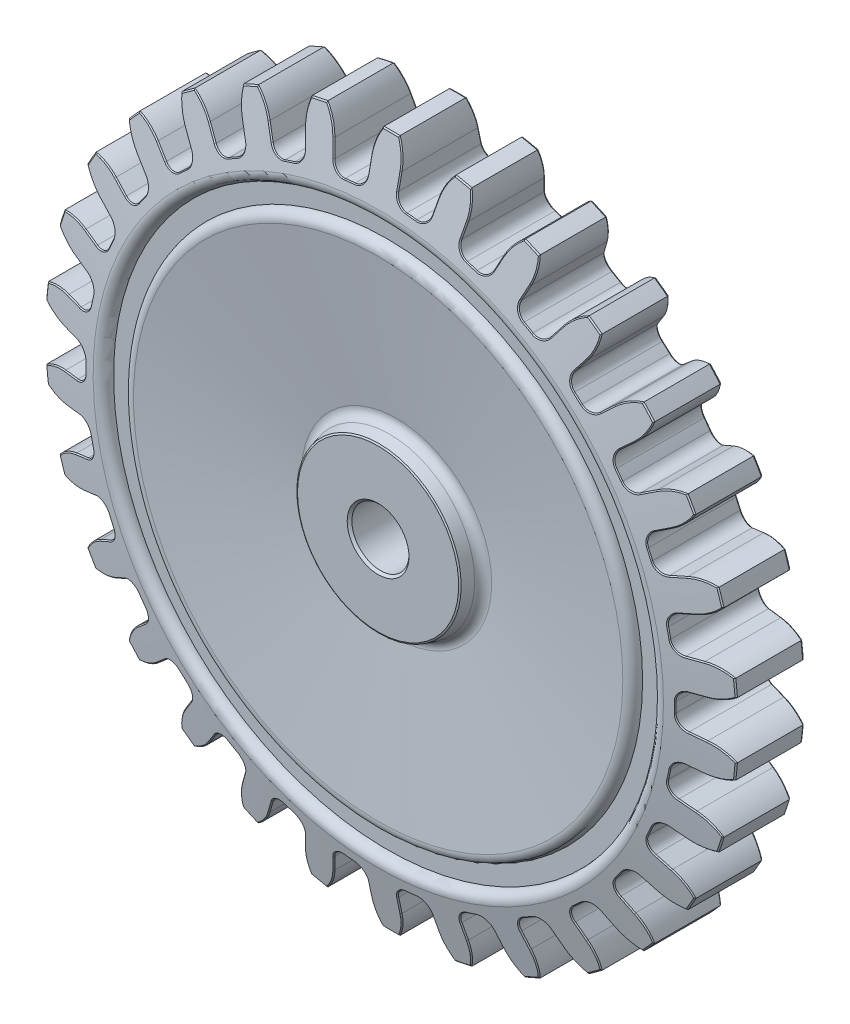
SolidWorks part; units mm, degrees
ref_plane "Спереди" through (0, 0, 0) normal (0, 0, 1) x (1, 0, 0)
ref_plane "Сверху" through (0, 0, 0) normal (0, 1, 0) x (1, 0, 0)
ref_plane "Справа" through (0, 0, 0) normal (1, 0, 0) x (0, 0, -1)
sketch "Эскиз2" plane through (0, 0, 0) normal (1, 0, 0) x (0, 0, -1)
  line L0 (-9.4803, 0) -> (8.8412, 0) construction
  line L1 (-5, 3.05) -> (5, 3.05)
  line L2 (5, 3.05) -> (5, 8.75)
  line L3 (-3.6, 37) -> (3.6, 37)
  line L4 (0, 0) -> (0, 37) construction
  line L5 (4, 29.25) -> (4, 27.25)
  line L6 (5, 8.75) -> (5, 36.8) construction
  line L7 (3.6, 37) -> (4.9785, 30.4561)
  line L8 (5, 8.75) -> (3.7666, 9.0805)
  line L9 (4.9925, 26.1281) -> (3.0329, 10.1683)
  line L10 (-5, 3.05) -> (-5, 8.75)
  line L11 (-5, 8.75) -> (-3.7666, 9.0805)
  line L12 (-4.9925, 26.1281) -> (-3.0329, 10.1683)
  line L13 (-4, 29.25) -> (-4, 27.25)
  line L14 (-3.6, 37) -> (-4.9785, 30.4561)
  arc A0 (4, 29.25) -> (4.9785, 30.4561) centre (4, 30.25) ccw
  arc A1 (4.9925, 26.1281) -> (4, 27.25) centre (4, 26.25) ccw
  arc A2 (3.0329, 10.1683) -> (3.7666, 9.0805) centre (4.0255, 10.0464) ccw
  arc A3 (-3.0329, 10.1683) -> (-3.7666, 9.0805) centre (-4.0255, 10.0464) cw
  arc A4 (-4.9925, 26.1281) -> (-4, 27.25) centre (-4, 26.25) cw
  arc A5 (-4, 29.25) -> (-4.9785, 30.4561) centre (-4, 30.25) cw
  point P19 (0, 3.05)
  dimension "D8" = 2
  dimension "D1" = 3.05
  dimension "D2" = 8.75
  dimension "D3" = 5
  dimension "D4" = 37
  dimension "D5" = 3.6
  dimension "D6" = 2
  dimension "D7" = 20.5
  dimension "D9" = 4
  dimension "D10" = 15
  dimension "D11" = 7
  dimension "D12" = 10.0464
revolve "Повернуть1" add sketch "Эскиз2" angle 360 about L0
sketch "Эскиз3" plane through (0, 0, 0) normal (0, 0, 1) x (1, 0, 0)
  line L0 (0, 42.1478) -> (0, 0) construction
  line L1 (0, 0) -> (3.6062, 34.311) construction
  line L2 (-1.6, 34.311) -> (-1.6, 32.6441)
  line L3 (1.6, 34.311) -> (1.6, 32.6441)
  line L4 (5.5686, 33.8939) -> (5.222, 32.2634)
  line L5 (8.6987, 33.2286) -> (8.3521, 31.5981)
  line L6 (12.4939, 31.9954) -> (11.8159, 30.4726)
  line L7 (15.4172, 30.6939) -> (14.7392, 29.1711)
  line L8 (18.8731, 28.6986) -> (17.8933, 27.3501)
  line L9 (21.4619, 26.8177) -> (20.4821, 25.4692)
  line L10 (24.4274, 24.1476) -> (23.1887, 23.0322)
  line L11 (26.5687, 21.7695) -> (25.3299, 20.6541)
  line L12 (28.9142, 18.5411) -> (27.4706, 17.7077)
  line L13 (30.5142, 15.7699) -> (29.0706, 14.9364)
  line L14 (32.1373, 12.1244) -> (30.5519, 11.6093)
  line L15 (33.1261, 9.081) -> (31.5408, 8.5659)
  line L16 (33.9558, 5.1777) -> (32.298, 5.0035)
  line L17 (34.2903, 1.9952) -> (32.6325, 1.821)
  line L18 (34.2903, -1.9952) -> (32.6325, -1.821)
  line L19 (33.9558, -5.1777) -> (32.298, -5.0035)
  line L20 (33.1261, -9.081) -> (31.5408, -8.5659)
  line L21 (32.1373, -12.1244) -> (30.5519, -11.6093)
  line L22 (30.5142, -15.7699) -> (29.0706, -14.9364)
  line L23 (28.9142, -18.5411) -> (27.4706, -17.7077)
  line L24 (26.5687, -21.7695) -> (25.3299, -20.6541)
  line L25 (24.4274, -24.1476) -> (23.1887, -23.0322)
  line L26 (21.4619, -26.8177) -> (20.4821, -25.4692)
  line L27 (18.8731, -28.6986) -> (17.8933, -27.3501)
  line L28 (15.4172, -30.6939) -> (14.7392, -29.1711)
  line L29 (12.4939, -31.9954) -> (11.8159, -30.4726)
  line L30 (8.6987, -33.2286) -> (8.3521, -31.5981)
  line L31 (5.5686, -33.8939) -> (5.222, -32.2634)
  line L32 (1.6, -34.311) -> (1.6, -32.6441)
  line L33 (-1.6, -34.311) -> (-1.6, -32.6441)
  line L34 (-5.5686, -33.8939) -> (-5.222, -32.2634)
  line L35 (-8.6987, -33.2286) -> (-8.3521, -31.5981)
  line L36 (-12.4939, -31.9954) -> (-11.8159, -30.4726)
  line L37 (-15.4172, -30.6939) -> (-14.7392, -29.1711)
  line L38 (-18.8731, -28.6986) -> (-17.8933, -27.3501)
  line L39 (-21.4619, -26.8177) -> (-20.4821, -25.4692)
  line L40 (-24.4274, -24.1476) -> (-23.1887, -23.0322)
  line L41 (-26.5687, -21.7695) -> (-25.3299, -20.6541)
  line L42 (-28.9142, -18.5411) -> (-27.4706, -17.7077)
  line L43 (-30.5142, -15.7699) -> (-29.0706, -14.9364)
  line L44 (-32.1373, -12.1244) -> (-30.5519, -11.6093)
  line L45 (-33.1261, -9.081) -> (-31.5408, -8.5659)
  line L46 (-33.9558, -5.1777) -> (-32.298, -5.0035)
  line L47 (-34.2903, -1.9952) -> (-32.6325, -1.821)
  line L48 (-34.2903, 1.9952) -> (-32.6325, 1.821)
  line L49 (-33.9558, 5.1777) -> (-32.298, 5.0035)
  line L50 (-33.1261, 9.081) -> (-31.5408, 8.5659)
  line L51 (-32.1373, 12.1244) -> (-30.5519, 11.6093)
  line L52 (-30.5142, 15.7699) -> (-29.0706, 14.9364)
  line L53 (-28.9142, 18.5411) -> (-27.4706, 17.7077)
  line L54 (-26.5687, 21.7695) -> (-25.3299, 20.6541)
  line L55 (-24.4274, 24.1476) -> (-23.1887, 23.0322)
  line L56 (-21.4619, 26.8177) -> (-20.4821, 25.4692)
  line L57 (-18.8731, 28.6986) -> (-17.8933, 27.3501)
  line L58 (-15.4172, 30.6939) -> (-14.7392, 29.1711)
  line L59 (-12.4939, 31.9954) -> (-11.8159, 30.4726)
  line L60 (-8.6987, 33.2286) -> (-8.3521, 31.5981)
  line L61 (-5.5686, 33.8939) -> (-5.222, 32.2634)
  circle A0 centre (0, 0) radius 34.5 construction
  arc A1 (-0.8578, 36.9901) -> (-1.6, 34.311) centre (3.6062, 34.311) ccw
  arc A2 (-9.2225, 30.1197) -> (-10.2427, 29.7882) centre (0, 0) ccw
  circle A3 centre (0, 0) radius 37 construction
  arc A4 (0.8578, 36.9901) -> (-0.8578, 36.9901) centre (0, 0) ccw
  arc A5 (0.8578, 36.9901) -> (1.6, 34.311) centre (-3.6062, 34.311) cw
  arc A6 (6.8516, 36.3601) -> (5.5686, 33.8939) centre (10.6611, 32.8114) ccw
  arc A7 (8.5297, 36.0034) -> (6.8516, 36.3601) centre (0, 0) ccw
  arc A8 (8.5297, 36.0034) -> (8.6987, 33.2286) centre (3.6062, 34.311) cw
  arc A9 (14.2616, 34.141) -> (12.4939, 31.9954) centre (17.25, 29.8779) ccw
  arc A10 (15.8288, 33.4432) -> (14.2616, 34.141) centre (0, 0) ccw
  arc A11 (15.8288, 33.4432) -> (15.4172, 30.6939) centre (10.6611, 32.8114) cw
  arc A12 (21.0482, 30.4298) -> (18.8731, 28.6986) centre (23.085, 25.6385) ccw
  arc A13 (22.4362, 29.4214) -> (21.0482, 30.4298) centre (0, 0) ccw
  arc A14 (22.4362, 29.4214) -> (21.4619, 26.8177) centre (17.25, 29.8779) cw
  arc A15 (26.915, 25.3886) -> (24.4274, 24.1476) centre (27.9111, 20.2786) ccw
  arc A16 (28.0629, 24.1137) -> (26.915, 25.3886) centre (0, 0) ccw
  arc A17 (28.0629, 24.1137) -> (26.5687, 21.7695) centre (23.085, 25.6385) cw
  arc A18 (31.6054, 19.2379) -> (28.9142, 18.5411) centre (31.5173, 14.0324) ccw
  arc A19 (32.4632, 17.7522) -> (31.6054, 19.2379) centre (0, 0) ccw
  arc A20 (32.4632, 17.7522) -> (30.5142, 15.7699) centre (27.9111, 20.2786) cw
  arc A21 (34.9146, 12.2464) -> (32.1373, 12.1244) centre (33.7461, 7.173) ccw
  arc A22 (35.4447, 10.6147) -> (34.9146, 12.2464) centre (0, 0) ccw
  arc A23 (35.4447, 10.6147) -> (33.1261, 9.081) centre (31.5173, 14.0324) cw
  arc A24 (36.6978, 4.7196) -> (33.9558, 5.1777) centre (34.5, 0) ccw
  arc A25 (36.8771, 3.0134) -> (36.6978, 4.7196) centre (0, 0) ccw
  arc A26 (36.8771, 3.0134) -> (34.2903, 1.9952) centre (33.7461, 7.173) cw
  arc A27 (36.8771, -3.0134) -> (34.2903, -1.9952) centre (33.7461, -7.173) ccw
  arc A28 (36.6978, -4.7196) -> (36.8771, -3.0134) centre (0, 0) ccw
  arc A29 (36.6978, -4.7196) -> (33.9558, -5.1777) centre (34.5, 0) cw
  arc A30 (35.4447, -10.6147) -> (33.1261, -9.081) centre (31.5173, -14.0324) ccw
  arc A31 (34.9146, -12.2464) -> (35.4447, -10.6147) centre (0, 0) ccw
  arc A32 (34.9146, -12.2464) -> (32.1373, -12.1244) centre (33.7461, -7.173) cw
  arc A33 (32.4632, -17.7522) -> (30.5142, -15.7699) centre (27.9111, -20.2786) ccw
  arc A34 (31.6054, -19.2379) -> (32.4632, -17.7522) centre (0, 0) ccw
  arc A35 (31.6054, -19.2379) -> (28.9142, -18.5411) centre (31.5173, -14.0324) cw
  arc A36 (28.0629, -24.1137) -> (26.5687, -21.7695) centre (23.085, -25.6385) ccw
  arc A37 (26.915, -25.3886) -> (28.0629, -24.1137) centre (0, 0) ccw
  arc A38 (26.915, -25.3886) -> (24.4274, -24.1476) centre (27.9111, -20.2786) cw
  arc A39 (22.4362, -29.4214) -> (21.4619, -26.8177) centre (17.25, -29.8779) ccw
  arc A40 (21.0482, -30.4298) -> (22.4362, -29.4214) centre (0, 0) ccw
  arc A41 (21.0482, -30.4298) -> (18.8731, -28.6986) centre (23.085, -25.6385) cw
  arc A42 (15.8288, -33.4432) -> (15.4172, -30.6939) centre (10.6611, -32.8114) ccw
  arc A43 (14.2616, -34.141) -> (15.8288, -33.4432) centre (0, 0) ccw
  arc A44 (14.2616, -34.141) -> (12.4939, -31.9954) centre (17.25, -29.8779) cw
  arc A45 (8.5297, -36.0034) -> (8.6987, -33.2286) centre (3.6062, -34.311) ccw
  arc A46 (6.8516, -36.3601) -> (8.5297, -36.0034) centre (0, 0) ccw
  arc A47 (6.8516, -36.3601) -> (5.5686, -33.8939) centre (10.6611, -32.8114) cw
  arc A48 (0.8578, -36.9901) -> (1.6, -34.311) centre (-3.6062, -34.311) ccw
  arc A49 (-0.8578, -36.9901) -> (0.8578, -36.9901) centre (0, 0) ccw
  arc A50 (-0.8578, -36.9901) -> (-1.6, -34.311) centre (3.6062, -34.311) cw
  arc A51 (-6.8516, -36.3601) -> (-5.5686, -33.8939) centre (-10.6611, -32.8114) ccw
  arc A52 (-8.5297, -36.0034) -> (-6.8516, -36.3601) centre (0, 0) ccw
  arc A53 (-8.5297, -36.0034) -> (-8.6987, -33.2286) centre (-3.6062, -34.311) cw
  arc A54 (-14.2616, -34.141) -> (-12.4939, -31.9954) centre (-17.25, -29.8779) ccw
  arc A55 (-15.8288, -33.4432) -> (-14.2616, -34.141) centre (0, 0) ccw
  arc A56 (-15.8288, -33.4432) -> (-15.4172, -30.6939) centre (-10.6611, -32.8114) cw
  arc A57 (-21.0482, -30.4298) -> (-18.8731, -28.6986) centre (-23.085, -25.6385) ccw
  arc A58 (-22.4362, -29.4214) -> (-21.0482, -30.4298) centre (0, 0) ccw
  arc A59 (-22.4362, -29.4214) -> (-21.4619, -26.8177) centre (-17.25, -29.8779) cw
  arc A60 (-26.915, -25.3886) -> (-24.4274, -24.1476) centre (-27.9111, -20.2786) ccw
  arc A61 (-28.0629, -24.1137) -> (-26.915, -25.3886) centre (0, 0) ccw
  arc A62 (-28.0629, -24.1137) -> (-26.5687, -21.7695) centre (-23.085, -25.6385) cw
  arc A63 (-31.6054, -19.2379) -> (-28.9142, -18.5411) centre (-31.5173, -14.0324) ccw
  arc A64 (-32.4632, -17.7522) -> (-31.6054, -19.2379) centre (0, 0) ccw
  arc A65 (-32.4632, -17.7522) -> (-30.5142, -15.7699) centre (-27.9111, -20.2786) cw
  arc A66 (-34.9146, -12.2464) -> (-32.1373, -12.1244) centre (-33.7461, -7.173) ccw
  arc A67 (-35.4447, -10.6147) -> (-34.9146, -12.2464) centre (0, 0) ccw
  arc A68 (-35.4447, -10.6147) -> (-33.1261, -9.081) centre (-31.5173, -14.0324) cw
  arc A69 (-36.6978, -4.7196) -> (-33.9558, -5.1777) centre (-34.5, 0) ccw
  arc A70 (-36.8771, -3.0134) -> (-36.6978, -4.7196) centre (0, 0) ccw
  arc A71 (-36.8771, -3.0134) -> (-34.2903, -1.9952) centre (-33.7461, -7.173) cw
  arc A72 (-36.8771, 3.0134) -> (-34.2903, 1.9952) centre (-33.7461, 7.173) ccw
  arc A73 (-36.6978, 4.7196) -> (-36.8771, 3.0134) centre (0, 0) ccw
  arc A74 (-36.6978, 4.7196) -> (-33.9558, 5.1777) centre (-34.5, 0) cw
  arc A75 (-35.4447, 10.6147) -> (-33.1261, 9.081) centre (-31.5173, 14.0324) ccw
  arc A76 (-34.9146, 12.2464) -> (-35.4447, 10.6147) centre (0, 0) ccw
  arc A77 (-34.9146, 12.2464) -> (-32.1373, 12.1244) centre (-33.7461, 7.173) cw
  arc A78 (-32.4632, 17.7522) -> (-30.5142, 15.7699) centre (-27.9111, 20.2786) ccw
  arc A79 (-31.6054, 19.2379) -> (-32.4632, 17.7522) centre (0, 0) ccw
  arc A80 (-31.6054, 19.2379) -> (-28.9142, 18.5411) centre (-31.5173, 14.0324) cw
  arc A81 (-28.0629, 24.1137) -> (-26.5687, 21.7695) centre (-23.085, 25.6385) ccw
  arc A82 (-26.915, 25.3886) -> (-28.0629, 24.1137) centre (0, 0) ccw
  arc A83 (-26.915, 25.3886) -> (-24.4274, 24.1476) centre (-27.9111, 20.2786) cw
  arc A84 (-22.4362, 29.4214) -> (-21.4619, 26.8177) centre (-17.25, 29.8779) ccw
  arc A85 (-21.0482, 30.4298) -> (-22.4362, 29.4214) centre (0, 0) ccw
  arc A86 (-21.0482, 30.4298) -> (-18.8731, 28.6986) centre (-23.085, 25.6385) cw
  arc A87 (-15.8288, 33.4432) -> (-15.4172, 30.6939) centre (-10.6611, 32.8114) ccw
  arc A88 (-14.2616, 34.141) -> (-15.8288, 33.4432) centre (0, 0) ccw
  arc A89 (-14.2616, 34.141) -> (-12.4939, 31.9954) centre (-17.25, 29.8779) cw
  arc A90 (-8.5297, 36.0034) -> (-8.6987, 33.2286) centre (-3.6062, 34.311) ccw
  arc A91 (-6.8516, 36.3601) -> (-8.5297, 36.0034) centre (0, 0) ccw
  arc A92 (-6.8516, 36.3601) -> (-5.5686, 33.8939) centre (-10.6611, 32.8114) cw
  arc A93 (-2.7588, 31.379) -> (-3.8256, 31.2668) centre (0, 0) ccw
  arc A94 (3.8256, 31.2668) -> (2.7588, 31.379) centre (0, 0) ccw
  arc A95 (-15.2832, 27.544) -> (-16.2122, 27.0077) centre (0, 0) ccw
  arc A96 (-20.676, 23.7645) -> (-21.4731, 23.0468) centre (0, 0) ccw
  arc A97 (-25.1651, 18.9465) -> (-25.7956, 18.0786) centre (0, 0) ccw
  arc A98 (-28.5544, 13.3003) -> (-28.9907, 12.3204) centre (0, 0) ccw
  arc A99 (-30.6957, 7.0729) -> (-30.9187, 6.0237) centre (0, 0) ccw
  arc A100 (-31.4954, 0.5363) -> (-31.4954, -0.5363) centre (0, 0) ccw
  arc A101 (-30.9187, -6.0237) -> (-30.6957, -7.0729) centre (0, 0) ccw
  arc A102 (-28.9907, -12.3204) -> (-28.5544, -13.3003) centre (0, 0) ccw
  arc A103 (-25.7956, -18.0786) -> (-25.1651, -18.9465) centre (0, 0) ccw
  arc A104 (-21.4731, -23.0468) -> (-20.676, -23.7645) centre (0, 0) ccw
  arc A105 (-16.2122, -27.0077) -> (-15.2832, -27.544) centre (0, 0) ccw
  arc A106 (-10.2427, -29.7882) -> (-9.2225, -30.1197) centre (0, 0) ccw
  arc A107 (-3.8256, -31.2668) -> (-2.7588, -31.379) centre (0, 0) ccw
  arc A108 (2.7588, -31.379) -> (3.8256, -31.2668) centre (0, 0) ccw
  arc A109 (9.2225, -30.1197) -> (10.2427, -29.7882) centre (0, 0) ccw
  arc A110 (15.2832, -27.544) -> (16.2122, -27.0077) centre (0, 0) ccw
  arc A111 (20.676, -23.7645) -> (21.4731, -23.0468) centre (0, 0) ccw
  arc A112 (25.1651, -18.9465) -> (25.7956, -18.0786) centre (0, 0) ccw
  arc A113 (28.5544, -13.3003) -> (28.9907, -12.3204) centre (0, 0) ccw
  arc A114 (30.6957, -7.0729) -> (30.9187, -6.0237) centre (0, 0) ccw
  arc A115 (31.4954, -0.5363) -> (31.4954, 0.5363) centre (0, 0) ccw
  arc A116 (30.9187, 6.0237) -> (30.6957, 7.0729) centre (0, 0) ccw
  arc A117 (28.9907, 12.3204) -> (28.5544, 13.3003) centre (0, 0) ccw
  arc A118 (25.7956, 18.0786) -> (25.1651, 18.9465) centre (0, 0) ccw
  arc A119 (21.4731, 23.0468) -> (20.676, 23.7645) centre (0, 0) ccw
  arc A120 (16.2122, 27.0077) -> (15.2832, 27.544) centre (0, 0) ccw
  arc A121 (10.2427, 29.7882) -> (9.2225, 30.1197) centre (0, 0) ccw
  arc A122 (-8.3521, 31.5981) -> (-9.2225, 30.1197) centre (-9.5944, 31.334) cw
  arc A123 (-11.8159, 30.4726) -> (-10.2427, 29.7882) centre (-10.6557, 30.9892) ccw
  arc A124 (-14.7392, 29.1711) -> (-15.2832, 27.544) centre (-15.8994, 28.6545) cw
  arc A125 (-17.8933, 27.3501) -> (-16.2122, 27.0077) centre (-16.8658, 28.0966) ccw
  arc A126 (-20.4821, 25.4692) -> (-20.676, 23.7645) centre (-21.5096, 24.7227) cw
  arc A127 (-23.1887, 23.0322) -> (-21.4731, 23.0468) centre (-22.3389, 23.976) ccw
  arc A128 (-25.3299, 20.6541) -> (-25.1651, 18.9465) centre (-26.1797, 19.7103) cw
  arc A129 (-27.4706, 17.7077) -> (-25.7956, 18.0786) centre (-26.8356, 18.8075) ccw
  arc A130 (-29.0706, 14.9364) -> (-28.5544, 13.3003) centre (-29.7056, 13.8365) cw
  arc A131 (-30.5519, 11.6093) -> (-28.9907, 12.3204) centre (-30.1595, 12.8171) ccw
  arc A132 (-31.5408, 8.5659) -> (-30.6957, 7.0729) centre (-31.9332, 7.358) cw
  arc A133 (-32.298, 5.0035) -> (-30.9187, 6.0237) centre (-32.1653, 6.2665) ccw
  arc A134 (-32.6325, 1.821) -> (-31.4954, 0.5363) centre (-32.7652, 0.558) cw
  arc A135 (-32.6325, -1.821) -> (-31.4954, -0.5363) centre (-32.7652, -0.558) ccw
  arc A136 (-29.0706, -14.9364) -> (-28.5544, -13.3003) centre (-29.7056, -13.8365) ccw
  arc A137 (-30.5519, -11.6093) -> (-28.9907, -12.3204) centre (-30.1595, -12.8171) cw
  arc A138 (-31.5408, -8.5659) -> (-30.6957, -7.0729) centre (-31.9332, -7.358) ccw
  arc A139 (-32.298, -5.0035) -> (-30.9187, -6.0237) centre (-32.1653, -6.2665) cw
  arc A140 (-27.4706, -17.7077) -> (-25.7956, -18.0786) centre (-26.8356, -18.8075) cw
  arc A141 (-25.3299, -20.6541) -> (-25.1651, -18.9465) centre (-26.1797, -19.7103) ccw
  arc A142 (-20.4821, -25.4692) -> (-20.676, -23.7645) centre (-21.5096, -24.7227) ccw
  arc A143 (-23.1887, -23.0322) -> (-21.4731, -23.0468) centre (-22.3389, -23.976) cw
  arc A144 (-17.8933, -27.3501) -> (-16.2122, -27.0077) centre (-16.8658, -28.0966) cw
  arc A145 (-14.7392, -29.1711) -> (-15.2832, -27.544) centre (-15.8994, -28.6545) ccw
  arc A146 (-11.8159, -30.4726) -> (-10.2427, -29.7882) centre (-10.6557, -30.9892) cw
  arc A147 (-8.3521, -31.5981) -> (-9.2225, -30.1197) centre (-9.5944, -31.334) ccw
  arc A148 (-5.222, -32.2634) -> (-3.8256, -31.2668) centre (-3.9798, -32.5274) cw
  arc A149 (-1.6, -32.6441) -> (-2.7588, -31.379) centre (-2.87, -32.6441) ccw
  arc A150 (8.3521, -31.5981) -> (9.2225, -30.1197) centre (9.5944, -31.334) cw
  arc A151 (5.222, -32.2634) -> (3.8256, -31.2668) centre (3.9798, -32.5274) ccw
  arc A152 (1.6, -32.6441) -> (2.7588, -31.379) centre (2.87, -32.6441) cw
  arc A153 (11.8159, -30.4726) -> (10.2427, -29.7882) centre (10.6557, -30.9892) ccw
  arc A154 (14.7392, -29.1711) -> (15.2832, -27.544) centre (15.8994, -28.6545) cw
  arc A155 (17.8933, -27.3501) -> (16.2122, -27.0077) centre (16.8658, -28.0966) ccw
  arc A156 (20.4821, -25.4692) -> (20.676, -23.7645) centre (21.5096, -24.7227) cw
  arc A157 (23.1887, -23.0322) -> (21.4731, -23.0468) centre (22.3389, -23.976) ccw
  arc A158 (25.3299, -20.6541) -> (25.1651, -18.9465) centre (26.1797, -19.7103) cw
  arc A159 (27.4706, -17.7077) -> (25.7956, -18.0786) centre (26.8356, -18.8075) ccw
  arc A160 (29.0706, -14.9364) -> (28.5544, -13.3003) centre (29.7056, -13.8365) cw
  arc A161 (30.5519, -11.6093) -> (28.9907, -12.3204) centre (30.1595, -12.8171) ccw
  arc A162 (31.5408, -8.5659) -> (30.6957, -7.0729) centre (31.9332, -7.358) cw
  arc A163 (32.298, -5.0035) -> (30.9187, -6.0237) centre (32.1653, -6.2665) ccw
  arc A164 (32.6325, -1.821) -> (31.4954, -0.5363) centre (32.7652, -0.558) cw
  arc A165 (32.6325, 1.821) -> (31.4954, 0.5363) centre (32.7652, 0.558) ccw
  arc A166 (32.298, 5.0035) -> (30.9187, 6.0237) centre (32.1653, 6.2665) cw
  arc A167 (31.5408, 8.5659) -> (30.6957, 7.0729) centre (31.9332, 7.358) ccw
  arc A168 (30.5519, 11.6093) -> (28.9907, 12.3204) centre (30.1595, 12.8171) cw
  arc A169 (29.0706, 14.9364) -> (28.5544, 13.3003) centre (29.7056, 13.8365) ccw
  arc A170 (27.4706, 17.7077) -> (25.7956, 18.0786) centre (26.8356, 18.8075) cw
  arc A171 (25.3299, 20.6541) -> (25.1651, 18.9465) centre (26.1797, 19.7103) ccw
  arc A172 (23.1887, 23.0322) -> (21.4731, 23.0468) centre (22.3389, 23.976) cw
  arc A173 (20.4821, 25.4692) -> (20.676, 23.7645) centre (21.5096, 24.7227) ccw
  arc A174 (17.8933, 27.3501) -> (16.2122, 27.0077) centre (16.8658, 28.0966) cw
  arc A175 (-5.222, 32.2634) -> (-3.8256, 31.2668) centre (-3.9798, 32.5274) ccw
  arc A176 (-1.6, 32.6441) -> (-2.7588, 31.379) centre (-2.87, 32.6441) cw
  arc A177 (14.7392, 29.1711) -> (15.2832, 27.544) centre (15.8994, 28.6545) ccw
  arc A178 (11.8159, 30.4726) -> (10.2427, 29.7882) centre (10.6557, 30.9892) cw
  arc A179 (8.3521, 31.5981) -> (9.2225, 30.1197) centre (9.5944, 31.334) ccw
  arc A180 (5.222, 32.2634) -> (3.8256, 31.2668) centre (3.9798, 32.5274) cw
  arc A181 (1.6, 32.6441) -> (2.7588, 31.379) centre (2.87, 32.6441) ccw
  point P384 (-1.6, 31.4593)
  point P395 (1.6, 31.4593)
  dimension "D1" = 69
  dimension "D3" = 1.6
  dimension "D4" = 63
  dimension "D6" = 1.27
  dimension "D7" = 5.2062
  dimension "D2" = 6
  dimension "D5" = 30
extrude "Вырез-Вытянуть1" cut sketch "Эскиз3" against normal mid plane 10 flip side to cut
chamfer "Фаска1" distance 0.25 angle 45 2 edges at (3.05, 0, 5) (3.05, 0, -5)
chamfer "Фаска2" distance 0.1 angle 45 400 edges at (0, 37, -3.6) (-1.4993, 35.3298, -3.9451) (-1.8884, 31.8383, -4.6756) (-3.2926, 31.3274, -4.7586) (-4.6318, 31.4376, -4.7003) (-6.2288, 35.5427, -3.7929) (-7.6927, 36.1915, -3.6) (-8.8121, 34.246, -3.9451) (-8.4667, 30.7499, -4.6756) (-9.734, 29.9583, -4.7586) (-11.0668, 29.7876, -4.7003) (-13.4824, 33.4709, -3.7929) (-15.0493, 33.8012, -3.6) (-15.7396, 31.6655, -3.9451) (-14.6749, 28.3177, -4.6756) (-15.75, 27.2798, -4.7586) (-17.0181, 26.8357, -4.7003) (-20.1468, 29.9364, -3.7929) (-21.7481, 29.9336, -3.6) (-21.9793, 27.7011, -3.9451) (-20.2418, 24.6478, -4.6756) (-21.0776, 23.4091, -4.7586) (-22.2257, 22.711, -4.7003) (-25.9306, 25.0934, -3.7929) (-27.4964, 24.7578, -3.6) (-27.2584, 22.526, -3.9451) (-24.924, 19.9007, -4.6756) (-25.484, 18.5152, -4.7586) (-26.4619, 17.5938, -4.7003) (-30.5812, 19.1538, -3.7929) (-32.0429, 18.5, -3.6) (-31.3462, 16.3664, -3.9451) (-28.517, 14.2838, -4.6756) (-28.7767, 12.8122, -4.7586) (-29.5416, 11.7075, -4.7003) (-33.8953, 12.377, -3.7929) (-35.1891, 11.4336, -3.6) (-34.064, 9.4916, -3.9451) (-30.8636, 8.0426, -4.6756) (-30.8116, 6.5492, -4.7586) (-31.3302, 5.3096, -4.7003) (-35.7279, 5.0594, -3.7929) (-36.7973, 3.8676, -3.6) (-35.293, 2.2018, -3.9451) (-31.8613, 1.45, -4.6756) (-31.5, 0, -4.7586) (-31.7495, -1.3203, -4.7003) (-35.9991, -2.4794, -3.7929) (-36.7973, -3.8676, -3.6) (-34.9795, -5.1841, -3.9451) (-31.4665, -5.206, -4.6756) (-30.8116, -6.5492, -4.7586) (-30.7812, -7.8925, -4.7003) (-34.6969, -9.9099, -3.7929) (-35.1891, -11.4336, -3.6) (-33.1373, -12.3435, -3.9451) (-29.6965, -11.6345, -4.6756) (-28.7767, -12.8122, -4.7586) (-28.4676, -14.1198, -4.7003) (-31.8783, -16.9072, -3.7929) (-32.0429, -18.5, -3.6) (-29.8468, -18.9634, -3.9451) (-26.6286, -17.5545, -4.6756) (-25.484, -18.5152, -4.7586) (-24.9098, -19.73, -4.7003) (-27.6664, -23.1656, -3.7929) (-27.4964, -24.7578, -3.6) (-25.2519, -24.7545, -3.9451) (-22.397, -22.7073, -4.6756) (-21.0776, -23.4091, -4.7586) (-20.2634, -24.4779, -4.7003) (-22.2455, -28.4115, -3.7929) (-21.7481, -29.9336, -3.6) (-19.5533, -29.4637, -3.9451) (-17.1864, -26.8677, -4.6756) (-15.75, -27.2798, -4.7586) (-14.7314, -28.156, -4.7003) (-15.8523, -32.4158, -3.7929) (-15.0493, -33.8012, -3.6) (-13.0002, -32.8852, -3.9451) (-11.2247, -29.8538, -4.6756) (-9.734, -29.9583, -4.7586) (-8.5555, -30.6036, -4.7003) (-8.7662, -35.0033, -3.7929) (-7.6927, -36.1915, -3.6) (-5.8789, -34.8695, -3.9451) (-4.7724, -31.5352, -4.6756) (-3.2926, -31.3274, -4.7586) (-2.0057, -31.7136, -4.7003) (-1.2971, -36.061, -3.7929) (0, -37, -3.6) (1.4993, -35.3298, -3.9451) (1.8884, -31.8383, -4.6756) (3.2926, -31.3274, -4.7586) (4.6318, -31.4376, -4.7003) (6.2288, -35.5427, -3.7929) (7.6927, -36.1915, -3.6) (8.8121, -34.246, -3.9451) (8.4667, -30.7499, -4.6756) (9.734, -29.9583, -4.7586) (11.0668, -29.7876, -4.7003) (13.4824, -33.4709, -3.7929) (15.0493, -33.8012, -3.6) (15.7396, -31.6655, -3.9451) (14.6749, -28.3177, -4.6756) (15.75, -27.2798, -4.7586) (17.0181, -26.8357, -4.7003) (20.1468, -29.9364, -3.7929) (21.7481, -29.9336, -3.6) (21.9793, -27.7011, -3.9451) (20.2418, -24.6478, -4.6756) (21.0776, -23.4091, -4.7586) (22.2257, -22.711, -4.7003) (25.9306, -25.0934, -3.7929) (27.4964, -24.7578, -3.6) (27.2584, -22.526, -3.9451) (24.924, -19.9007, -4.6756) (25.484, -18.5152, -4.7586) (26.4619, -17.5938, -4.7003) (30.5812, -19.1538, -3.7929) (32.0429, -18.5, -3.6) (31.3462, -16.3664, -3.9451) (28.517, -14.2838, -4.6756) (28.7767, -12.8122, -4.7586) (29.5416, -11.7075, -4.7003) (33.8953, -12.377, -3.7929) (35.1891, -11.4336, -3.6) (34.064, -9.4916, -3.9451) (30.8636, -8.0426, -4.6756) (30.8116, -6.5492, -4.7586) (31.3302, -5.3096, -4.7003) (35.7279, -5.0594, -3.7929) (36.7973, -3.8676, -3.6) (35.293, -2.2018, -3.9451) (31.8613, -1.45, -4.6756) (31.5, 0, -4.7586) (31.7495, 1.3203, -4.7003) (35.9991, 2.4794, -3.7929) (36.7973, 3.8676, -3.6) (34.9795, 5.1841, -3.9451) (31.4665, 5.206, -4.6756) (30.8116, 6.5492, -4.7586) (30.7812, 7.8925, -4.7003) (34.6969, 9.9099, -3.7929) (35.1891, 11.4336, -3.6) (33.1373, 12.3435, -3.9451) (29.6965, 11.6345, -4.6756) (28.7767, 12.8122, -4.7586) (28.4676, 14.1198, -4.7003) (31.8783, 16.9072, -3.7929) (32.0429, 18.5, -3.6) (29.8468, 18.9634, -3.9451) (26.6286, 17.5545, -4.6756) (25.484, 18.5152, -4.7586) (24.9098, 19.73, -4.7003) (27.6664, 23.1656, -3.7929) (27.4964, 24.7578, -3.6) (25.2519, 24.7545, -3.9451) (22.397, 22.7073, -4.6756) (21.0776, 23.4091, -4.7586) (20.2634, 24.4779, -4.7003) (22.2455, 28.4115, -3.7929) (21.7481, 29.9336, -3.6) (19.5533, 29.4637, -3.9451) (17.1864, 26.8677, -4.6756) (15.75, 27.2798, -4.7586) (14.7314, 28.156, -4.7003) (15.8523, 32.4158, -3.7929) (15.0493, 33.8012, -3.6) (13.0002, 32.8852, -3.9451) (11.2247, 29.8538, -4.6756) (9.734, 29.9583, -4.7586) (8.5555, 30.6036, -4.7003) (8.7662, 35.0033, -3.7929) (7.6927, 36.1915, -3.6) (5.8789, 34.8695, -3.9451) (4.7724, 31.5352, -4.6756) (3.2926, 31.3274, -4.7586) (2.0057, 31.7136, -4.7003) (1.2971, 36.061, -3.7929) (7.6927, 36.1915, 3.6) (8.8121, 34.246, 3.9451) (8.4667, 30.7499, 4.6756) (9.734, 29.9583, 4.7586) (11.0668, 29.7876, 4.7003) (13.4824, 33.4709, 3.7929) (15.0493, 33.8012, 3.6) (15.7396, 31.6655, 3.9451) (14.6749, 28.3177, 4.6756) (15.75, 27.2798, 4.7586) (17.0181, 26.8357, 4.7003) (20.1468, 29.9364, 3.7929) (21.7481, 29.9336, 3.6) (21.9793, 27.7011, 3.9451) (20.2418, 24.6478, 4.6756) (21.0776, 23.4091, 4.7586) (22.2257, 22.711, 4.7003) (25.9306, 25.0934, 3.7929) (27.4964, 24.7578, 3.6) (27.2584, 22.526, 3.9451) (24.924, 19.9007, 4.6756) (25.484, 18.5152, 4.7586) (26.4619, 17.5938, 4.7003) (30.5812, 19.1538, 3.7929) (32.0429, 18.5, 3.6) (31.3462, 16.3664, 3.9451) (28.517, 14.2838, 4.6756) (28.7767, 12.8122, 4.7586) (29.5416, 11.7075, 4.7003) (33.8953, 12.377, 3.7929) (35.1891, 11.4336, 3.6) (34.064, 9.4916, 3.9451) (30.8636, 8.0426, 4.6756) (30.8116, 6.5492, 4.7586) (31.3302, 5.3096, 4.7003) (35.7279, 5.0594, 3.7929) (36.7973, 3.8676, 3.6) (35.293, 2.2018, 3.9451) (31.8613, 1.45, 4.6756) (31.5, 0, 4.7586) (31.7495, -1.3203, 4.7003) (35.9991, -2.4794, 3.7929) (36.7973, -3.8676, 3.6) (34.9795, -5.1841, 3.9451) (31.4665, -5.206, 4.6756) (30.8116, -6.5492, 4.7586) (30.7812, -7.8925, 4.7003) (34.6969, -9.9099, 3.7929) (35.1891, -11.4336, 3.6) (33.1373, -12.3435, 3.9451) (29.6965, -11.6345, 4.6756) (28.7767, -12.8122, 4.7586) (28.4676, -14.1198, 4.7003) (31.8783, -16.9072, 3.7929) (32.0429, -18.5, 3.6) (29.8468, -18.9634, 3.9451) (26.6286, -17.5545, 4.6756) (25.484, -18.5152, 4.7586) (24.9098, -19.73, 4.7003) (27.6664, -23.1656, 3.7929) (27.4964, -24.7578, 3.6) (25.2519, -24.7545, 3.9451) (22.397, -22.7073, 4.6756) (21.0776, -23.4091, 4.7586) (20.2634, -24.4779, 4.7003) (22.2455, -28.4115, 3.7929) (21.7481, -29.9336, 3.6) (19.5533, -29.4637, 3.9451) (17.1864, -26.8677, 4.6756) (15.75, -27.2798, 4.7586) (14.7314, -28.156, 4.7003) (15.8523, -32.4158, 3.7929) (15.0493, -33.8012, 3.6) (13.0002, -32.8852, 3.9451) (11.2247, -29.8538, 4.6756) (9.734, -29.9583, 4.7586) (8.5555, -30.6036, 4.7003) (8.7662, -35.0033, 3.7929) (7.6927, -36.1915, 3.6) (5.8789, -34.8695, 3.9451) (4.7724, -31.5352, 4.6756) (3.2926, -31.3274, 4.7586) (2.0057, -31.7136, 4.7003) (1.2971, -36.061, 3.7929) (0, -37, 3.6) (-1.4993, -35.3298, 3.9451) (-1.8884, -31.8383, 4.6756) (-3.2926, -31.3274, 4.7586) (-4.6318, -31.4376, 4.7003) (-6.2288, -35.5427, 3.7929) (-7.6927, -36.1915, 3.6) (-8.8121, -34.246, 3.9451) (-8.4667, -30.7499, 4.6756) (-9.734, -29.9583, 4.7586) (-11.0668, -29.7876, 4.7003) (-13.4824, -33.4709, 3.7929) (-15.0493, -33.8012, 3.6) (-15.7396, -31.6655, 3.9451) (-14.6749, -28.3177, 4.6756) (-15.75, -27.2798, 4.7586) (-17.0181, -26.8357, 4.7003) (-20.1468, -29.9364, 3.7929) (-21.7481, -29.9336, 3.6) (-21.9793, -27.7011, 3.9451) (-20.2418, -24.6478, 4.6756) (-21.0776, -23.4091, 4.7586) (-22.2257, -22.711, 4.7003) (-25.9306, -25.0934, 3.7929) (-27.4964, -24.7578, 3.6) (-27.2584, -22.526, 3.9451) (-24.924, -19.9007, 4.6756) (-25.484, -18.5152, 4.7586) (-26.4619, -17.5938, 4.7003) (-30.5812, -19.1538, 3.7929) (-32.0429, -18.5, 3.6) (-31.3462, -16.3664, 3.9451) (-28.517, -14.2838, 4.6756) (-28.7767, -12.8122, 4.7586) (-29.5416, -11.7075, 4.7003) (-33.8953, -12.377, 3.7929)
